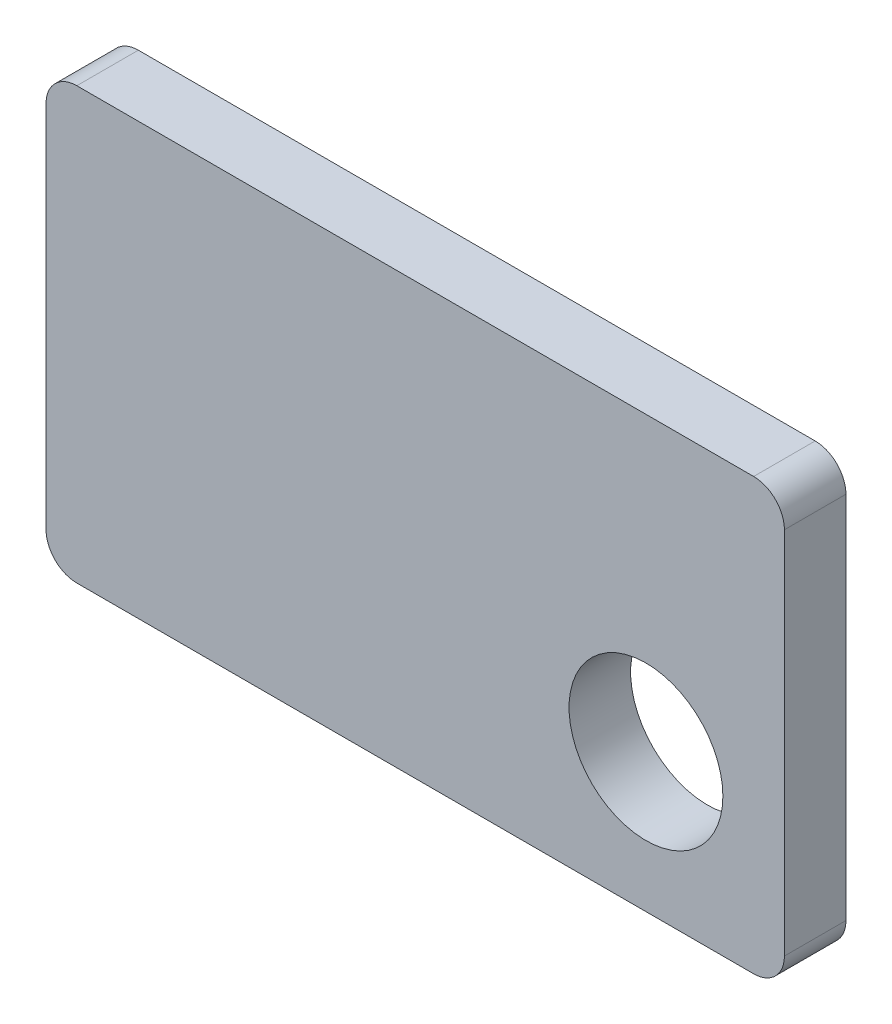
SolidWorks part; units mm, degrees
ref_plane "Front" through (0, 0, 0) normal (0, 0, 1) x (1, 0, 0)
ref_plane "Top" through (0, 0, 0) normal (0, 1, 0) x (1, 0, 0)
ref_plane "Right" through (0, 0, 0) normal (1, 0, 0) x (0, 0, -1)
sketch "Esquisse1" plane through (0, 0, 0) normal (0, 0, 1) x (1, 0, 0)
  line L1 (-6, 3.5) -> (6, 3.5)
  line L2 (-6, 3.5) -> (-6, -3.5)
  line L3 (-6, -3.5) -> (6, -3.5)
  line L4 (6, 3.5) -> (6, -3.5)
  line L5 (-6, 3.5) -> (6, -3.5) construction
  line L6 (-6, -3.5) -> (6, 3.5) construction
  point P0 (0, 0)
  dimension "D1" = 12
  dimension "D2" = 7
extrude "Boss.-Extru.1" add sketch "Esquisse1" along normal blind 1
fillet "Congé1" radius 0.5 4 edges at (-6, -3.5, 0.5) (-6, 3.5, 0.5) (6, -3.5, 0.5) (6, 3.5, 0.5)
sketch "Esquisse2" plane through (0, 0, 1) normal (0, 0, 1) x (1, 0, 0)
  line L0 (3.75, 3.5) -> (3.75, -3.5) construction
  line L1 (5.5, 3.5) -> (-5.5, 3.5) construction
  line L2 (-5.5, -3.5) -> (5.5, -3.5) construction
  line L3 (6, -3) -> (6, 3) construction
  line L4 (6, -1.25) -> (3.75, -1.25) construction
  circle A0 centre (3.75, -1.25) radius 1.25
  dimension "D3" = 2.5
  dimension "D1" = 2.25
  dimension "D2" = 2.25
extrude "Enlèv. mat.-Extru.1" cut sketch "Esquisse2" against normal up to next
